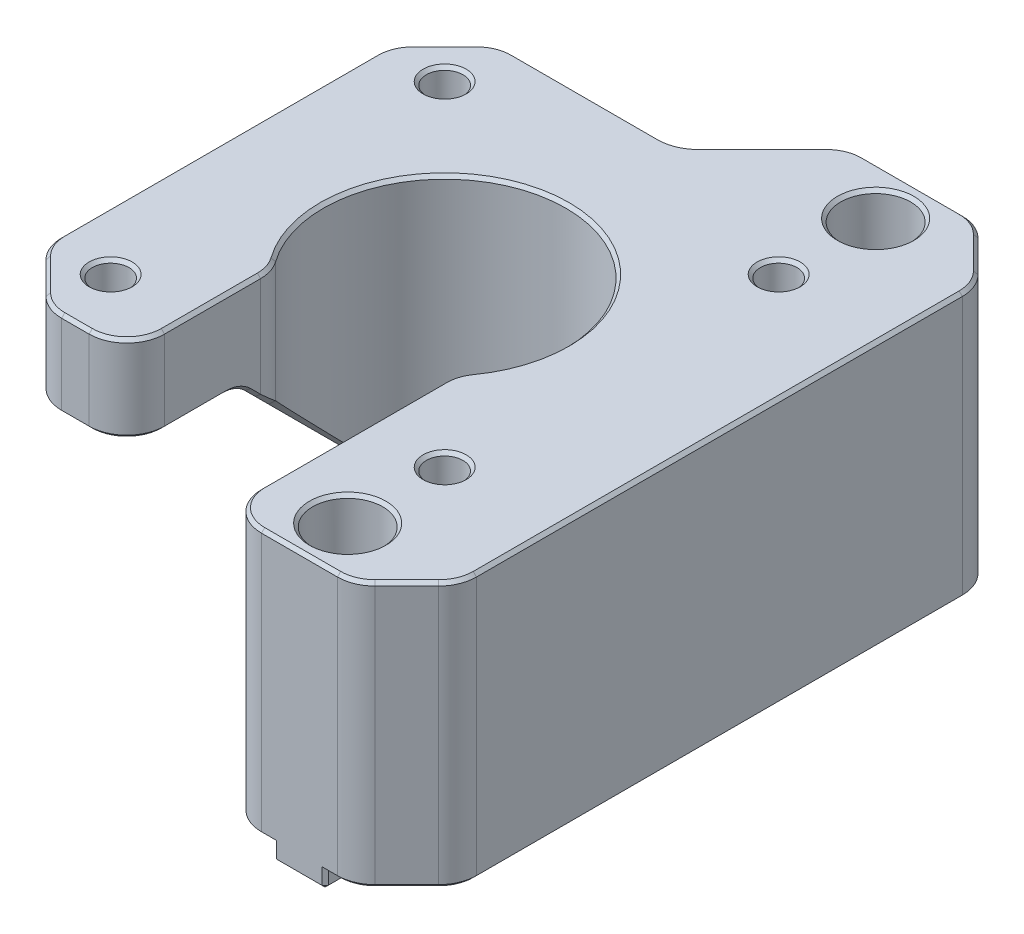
SolidWorks part; units mm, degrees
ref_plane "Aufriss" through (0, 0, 0) normal (0, 0, 1) x (1, 0, 0)
ref_plane "Grundriss" through (0, 0, 0) normal (0, 1, 0) x (1, 0, 0)
ref_plane "Seitenriss" through (0, 0, 0) normal (1, 0, 0) x (0, 0, -1)
sketch "Skizze1" plane through (0, 0, 0) normal (0, 1, 0) x (1, 0, 0)
  line L1 (-21, -21) -> (21, -21)
  line L2 (-21, -21) -> (-21, 21)
  line L3 (-21, 21) -> (21, 21)
  line L4 (21, -21) -> (21, 21)
  line L5 (-21, -21) -> (21, 21) construction
  line L6 (-21, 21) -> (21, -21) construction
  point P0 (0, 0)
  dimension "D1" = 42
  dimension "D2" = 42
extrude "Aufsatz-Linear austragen1" add sketch "Skizze1" along normal blind 24.6
sketch "Skizze2" plane through (0, 24.6, 0) normal (0, 1, 0) x (1, 0, 0)
  line L2 (-8.5, -21) -> (8.5, -21)
  line L4 (-8.5, -21) -> (-8.5, -7.3697)
  line L5 (8.5, -21) -> (8.5, -7.3697)
  line L6 (-21, -21) -> (21, -21) construction
  arc A0 (8.5, -7.3697) -> (-8.5, -7.3697) centre (0, 0) ccw
  dimension "D1" = 22.5
  dimension "D2" = 8.5
  dimension "D3" = 8.5
extrude "Schnitt-Linear austragen1" cut sketch "Skizze2" against normal through all
hole_wizard "Stirnsenkung für M3 Zylinderschraube mit Innensechskant1" positions "Skizze3" profile "Skizze4" counterbore size "M3" standard "DIN"
sketch "Skizze3" plane through (0, 0, 0) normal (0, -1, 0) x (-1, 0, 0)
  point P0 (15.5, -15.5)
  point P2 (15.5, 15.5)
  point P4 (-15.5, 15.5)
  point P6 (-15.5, -15.5)
  dimension "D1" = 15.5
  dimension "D2" = 15.5
  dimension "D3" = 15.5
  dimension "D4" = 15.5
sketch "Skizze4" plane through (-15.5, 0, 15.5) normal (1, 0, 0) x (0, 0, -1)
  line L0 (0, 0) -> (0, 24.6)
  line L1 (0, 24.6) -> (1.7, 24.6)
  line L3 (1.7, 24.6) -> (1.7, 3.4)
  line L4 (1.7, 3.4) -> (3.25, 3.4)
  line L5 (3.25, 3.4) -> (3.25, 0)
  line L7 (3.25, 0) -> (0, 0)
  line L11 (0, -6.35) -> (0, 107.95) construction
  dimension "Bohrerdurchmesser" = 3.4
  dimension "Bohrungstiefe" = 24.6
  dimension "Senkdurchmesser2" = 6.5
  dimension "Senktiefe2" = 3.4
sketch "Skizze5" plane through (21, 0, 0) normal (1, 0, 0) x (0, 0, -1)
  line L4 (-21, 0) -> (21, 0)
  line L5 (21, 0) -> (21, 24.6)
  line L6 (21, 24.6) -> (-21, 24.6)
  line L7 (-21, 24.6) -> (-21, 0)
  line L8 (-21, 0) -> (21, 0)
  line L9 (21, 0) -> (21, 24.6)
  line L10 (21, 24.6) -> (-21, 24.6)
  line L11 (-21, 24.6) -> (-21, 0)
  dimension "D1" = 0
extrude "Aufsatz-Linear austragen2" add sketch "Skizze5" along normal blind 4.5
sketch "Skizze6" plane through (0, 0, 0) normal (0, -1, 0) x (1, 0, 0)
  line L0 (8.5, 21) -> (25.5, 21) construction
  line L1 (17.9, 21) -> (13.1, 21)
  line L2 (17.9, 21) -> (17.9, 17.6915)
  line L3 (17.9, -21) -> (13.1, -21)
  line L4 (13.1, 21) -> (13.1, 17.6915)
  line L5 (25.5, -21) -> (-21, -21) construction
  line L6 (25.5, 21) -> (25.5, -21) construction
  line L7 (17.9, 13.3085) -> (17.9, -13.3085)
  line L8 (13.1, 13.3085) -> (13.1, -13.3085)
  line L9 (17.9, -17.6915) -> (17.9, -21)
  line L10 (13.1, -17.6915) -> (13.1, -21)
  circle A0 centre (15.5, 15.5) radius 3.25 construction
  arc A1 (17.9, 17.6915) -> (13.1, 17.6915) centre (15.5, 15.5) ccw
  circle A2 centre (15.5, -15.5) radius 3.25 construction
  arc A3 (17.9, -13.3085) -> (13.1, -13.3085) centre (15.5, -15.5) ccw
  arc A4 (13.1, 13.3085) -> (17.9, 13.3085) centre (15.5, 15.5) ccw
  arc A5 (13.1, -17.6915) -> (17.9, -17.6915) centre (15.5, -15.5) ccw
  point P8 (15.5, 21)
  dimension "D1" = 10
  dimension "D2" = 4.8
extrude "Aufsatz-Linear austragen3" add sketch "Skizze6" along normal blind 1.5
sketch "Skizze7" plane through (0, 0, 21) normal (0, 0, 1) x (1, 0, 0)
  line L8 (25.5, 24.6) -> (8.5, 24.6)
  line L9 (8.5, 24.6) -> (8.5, 0)
  line L10 (8.5, 0) -> (13.1, 0)
  line L11 (13.1, 0) -> (13.1, -1.5)
  line L12 (13.1, -1.5) -> (17.9, -1.5)
  line L13 (17.9, -1.5) -> (17.9, 0)
  line L14 (17.9, 0) -> (25.5, 0)
  line L15 (25.5, 0) -> (25.5, 24.6)
  line L16 (25.5, 24.6) -> (8.5, 24.6)
  line L17 (8.5, 24.6) -> (8.5, 0)
  line L18 (8.5, 0) -> (13.1, 0)
  line L19 (13.1, 0) -> (13.1, -1.5)
  line L20 (13.1, -1.5) -> (17.9, -1.5)
  line L21 (17.9, -1.5) -> (17.9, 0)
  line L22 (17.9, 0) -> (25.5, 0)
  line L23 (25.5, 0) -> (25.5, 24.6)
  dimension "D1" = 0
extrude "Aufsatz-Linear austragen4" add sketch "Skizze7" along normal blind 8
sketch "Skizze8" plane through (0, 0, -21) normal (0, 0, -1) x (-1, 0, 0)
  line L8 (-25.5, 24.6) -> (-25.5, 0)
  line L9 (-8.5, 24.6) -> (-25.5, 24.6)
  line L10 (-8.5, 0) -> (-8.5, 24.6)
  line L11 (-13.1, 0) -> (-8.5, 0)
  line L12 (-13.1, -1.5) -> (-13.1, 0)
  line L13 (-17.9, -1.5) -> (-13.1, -1.5)
  line L14 (-17.9, 0) -> (-17.9, -1.5)
  line L15 (-25.5, 0) -> (-17.9, 0)
  line L16 (-25.5, 24.6) -> (-25.5, 0)
  line L17 (-8.5, 24.6) -> (-25.5, 24.6)
  line L18 (-8.5, 0) -> (-8.5, 24.6)
  line L19 (-13.1, 0) -> (-8.5, 0)
  line L20 (-13.1, -1.5) -> (-13.1, 0)
  line L21 (-17.9, -1.5) -> (-13.1, -1.5)
  line L22 (-17.9, 0) -> (-17.9, -1.5)
  line L23 (-25.5, 0) -> (-17.9, 0)
  dimension "D1" = 0
extrude "Aufsatz-Linear austragen5" add sketch "Skizze8" along normal blind 8
hole_wizard "Stirnsenkung für M3 Zylinderschraube mit Innensechskant2" positions "Skizze9" profile "Skizze10" counterbore size "M3" standard "DIN"
sketch "Skizze9" plane through (0, 24.6, 0) normal (0, 1, 0) x (1, 0, 0)
  line L0 (25.5, 29) -> (25.5, -29) construction
  line L1 (8.5, 29) -> (25.5, 29) construction
  line L2 (25.5, -29) -> (8.5, -29) construction
  point P0 (15.5, -24.5)
  point P2 (15.5, 24.5)
  dimension "D1" = 10
  dimension "D2" = 4.5
  dimension "D3" = 4.5
sketch "Skizze10" plane through (15.5, 24.6, 24.5) normal (1, 0, 0) x (0, 0, 1)
  line L0 (0, 0) -> (0, 26.1)
  line L1 (0, 26.1) -> (1.7, 26.1)
  line L3 (1.7, 26.1) -> (1.7, 4.9)
  line L4 (1.7, 4.9) -> (3.25, 4.9)
  line L5 (3.25, 4.9) -> (3.25, 0)
  line L7 (3.25, 0) -> (0, 0)
  line L11 (0, -6.35) -> (0, 107.95) construction
  dimension "Bohrerdurchmesser" = 3.4
  dimension "Bohrungstiefe" = 26.1
  dimension "Senkdurchmesser2" = 6.5
  dimension "Senktiefe2" = 4.9
chamfer "Fase1" distance 5 angle 45 4 edges at (-21, 12.3, 21) (-21, 12.3, -21) (25.5, 12.3, 29) (25.5, 12.3, -29)
sketch "Skizze11" plane through (0, 24.6, 0) normal (0, 1, 0) x (1, 0, 0)
  line L0 (8.5, 21) -> (8.5, 29)
  line L1 (8.5, 29) -> (0.5, 21)
  line L2 (8.5, 21) -> (-16, 21) construction
  line L3 (0.5, 21) -> (8.5, 21)
extrude "Aufsatz-Linear austragen6" add sketch "Skizze11" against normal up to surface (24.6 mm away)
fillet "Verrundung1" radius 3.5 14 edges at (25.5, 12.3, -24) (20.5, 12.3, -29) (-16, 12.3, -21) (-21, 12.3, -16) (-21, 12.3, 16) (-16, 12.3, 21) (-8.5, 12.3, 7.3697) (8.5, 12.3, 7.3697) (-8.5, 12.3, 21) (8.5, 12.3, 29) (20.5, 12.3, 29) (25.5, 12.3, 24) (0.5, 12.3, -21) (8.5, 12.3, -29)
sketch "Skizze12" plane through (-21, 0, 0) normal (-1, 0, 0) x (0, 0, 1)
  line L0 (13.3085, 0) -> (-13.3085, 0) construction
  line L1 (-6, 0) -> (21, 0)
  line L2 (-6, 0) -> (-6, 16.6)
  line L3 (-6, 16.6) -> (21, 16.6)
  line L4 (21, 0) -> (21, 16.6)
  line L5 (21, 24.6) -> (21, 0) construction
  line L6 (-14.5503, 24.6) -> (14.5503, 24.6) construction
  dimension "D1" = 27
  dimension "D2" = 8
extrude "Schnitt-Linear austragen2" cut sketch "Skizze12" against normal up to surface (12.5 mm away)
hole_wizard "Stirnsenkung für M3 Zylinderschraube mit Innensechskant3" positions "Skizze13" profile "Skizze14" counterbore size "M3" standard "DIN"
sketch "Skizze13" plane through (0, 16.6, 0) normal (0, -1, 0) x (-1, 0, 0)
  point P0 (15.5, -15.5)
sketch "Skizze14" plane through (-15.5, 16.6, 15.5) normal (1, 0, 0) x (0, 0, -1)
  line L0 (0, 0) -> (0, 8)
  line L1 (0, 8) -> (1.7, 8)
  line L3 (1.7, 8) -> (1.7, 3.4)
  line L4 (1.7, 3.4) -> (3.25, 3.4)
  line L5 (3.25, 3.4) -> (3.25, 0)
  line L7 (3.25, 0) -> (0, 0)
  line L11 (0, -6.35) -> (0, 107.95) construction
  dimension "Bohrerdurchmesser" = 3.4
  dimension "Bohrungstiefe" = 8
  dimension "Senkdurchmesser2" = 6.5
  dimension "Senktiefe2" = 3.4
chamfer "Fase2" distance 16.6 angle 45 1 edges at (-15.2582, 16.6, -6)
fillet "Verrundung2" radius 3 2 edges at (-15.2582, 0, -6) (-14.75, 16.6, 10.6)
chamfer "Fase3" distance 0.3 angle 45 103 edges at (23, 24.6, 26.5) (25.2336, 24.6, 23.8896) (20.3896, 24.6, 28.7336) (25.5, 24.6, 0) (15.5251, 24.6, 29) (25.2336, 24.6, -23.8896) (9.5251, 24.6, 27.9749) (23, 24.6, -26.5) (8.5, 24.6, 17.0384) (20.3896, 24.6, -28.7336) (8.6671, 24.6, 7.5082) (14.5, 24.6, -29) (0, 24.6, -11.25) (8.6104, 24.6, -28.7336) (-8.6671, 24.6, 7.5082) (4.5, 0, -25) (4.5, 24.6, -25) (-8.5, 24.6, 13.0384) (0.3896, 24.6, -21.2664) (-9.5251, 24.6, 19.9749) (-7.75, 24.6, -21) (-13.2751, 24.6, 21) (-15.8896, 24.6, -20.7336) (-15.8896, 24.6, 20.7336) (-18.5, 24.6, -18.5) (-18.5, 24.6, 18.5) (-20.7336, 24.6, -15.8896) (-20.7336, 24.6, 15.8896) (-21, 24.6, 0) (15.5, -1.5, 26.2) (-15.5, 24.6, 13.8) (-15.5, 24.6, -17.2) (15.5, 24.6, -21.25) (15.5, 24.6, -17.2) (15.5, 24.6, 13.8) (15.5, 24.6, 27.75) (-15.5, 0, -18.75) (15.5, -1.5, -18.75) (17.9, -1.5, -23.3457) (17.9, -0.75, -29) (15.5, -1.5, -29) (13.1, -1.5, -23.3457) (13.1, -0.75, -29) (17.9, -1.5, 0) (15.5, -1.5, -12.25) (13.1, -1.5, 0) (15.5, -1.5, 12.25) (15.5, -1.5, 18.75) (13.1, -1.5, 23.3457) (17.9, -1.5, 23.3457) (17.9, -0.75, 29) (15.5, -1.5, 29) (13.1, -0.75, 29) (18.4751, 0, 29) (18.4751, 0, -29) (20.3896, 0, 28.7336) (20.3896, 0, -28.7336) (23, 0, 26.5) (23, 0, -26.5) (25.2336, 0, 23.8896) (25.2336, 0, -23.8896) (25.5, 0, 0) (11.5249, 0, -29) (8.6104, 0, -28.7336) (0.3896, 0, -21.2664) (-7.75, 0, -21) (-15.8896, 0, -20.7336) (-18.5, 0, -18.5) (-20.7336, 0, -15.8896) (-21, 0, -10.8964) (-21, 0.2284, -6.0946) (-21, 8.3, 2.3) (-21, 16.3716, 10.6946) (-21, 16.6, 13.1964) (-20.7336, 16.6, 15.8896) (-18.5, 16.6, 18.5) (-15.8896, 16.6, 20.7336) (-13.2751, 16.6, 21) (-9.5251, 16.6, 19.9749) (-8.5, 16.6, 14.6713) (-8.5, 16.3716, 10.6946) (-8.5, 15.1491, 9.1491) (-8.6671, 13.5082, 7.5082) (-11.2192, 6.8313, 0.8313) (-9.5508, 0.2951, -5.9452) (12.55, 0, 29) (6.8975, 0, -8.8874) (9.5251, 0, 27.9749) (8.6671, 0, 7.5082) (8.5, 0, 17.0384) (17.9, -0.75, 13.3085) (17.9, -0.75, 17.6915) (13.1, -0.75, 13.3085) (13.1, -0.75, 17.6915) (13.1, -0.75, -13.3085) (17.9, -0.75, -13.3085) (18.75, 0, 15.5) (12.25, 0, 15.5) (18.75, 0, -15.5) (12.25, 0, -15.5) (13.1, -0.75, -17.6915) (17.9, -0.75, -17.6915) (-15.5, 16.6, 12.25)
